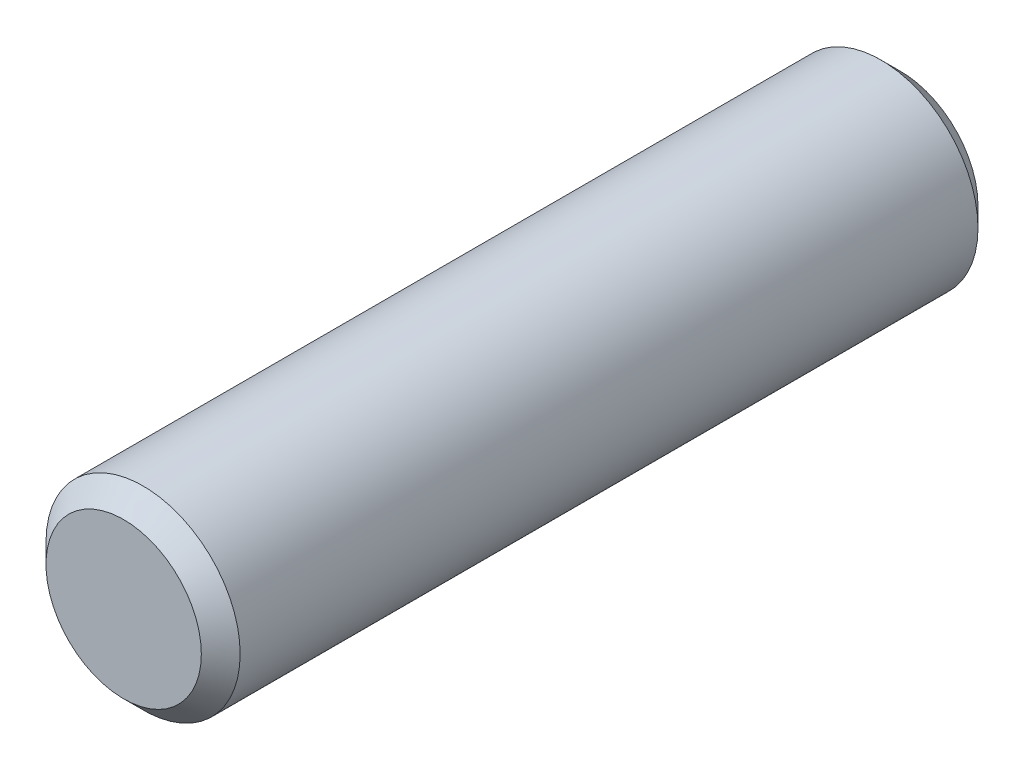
SolidWorks part; units mm, degrees
ref_plane "Front Plane" through (0, 0, 0) normal (0, 0, 1) x (1, 0, 0)
ref_plane "Top Plane" through (0, 0, 0) normal (0, 1, 0) x (1, 0, 0)
ref_plane "Right Plane" through (0, 0, 0) normal (1, 0, 0) x (0, 0, -1)
sketch "Sketch1" plane through (0, 0, 0) normal (0, 0, 1) x (1, 0, 0)
  circle A0 centre (0, 0) radius 1.5
  dimension "D1" = 3
extrude "Extrude1" add sketch "Sketch1" along normal mid plane 12
chamfer "Chamfer1" distance 0.3 angle 45 2 edges at (1.5, 0, -6) (1.5, 0, 6)
